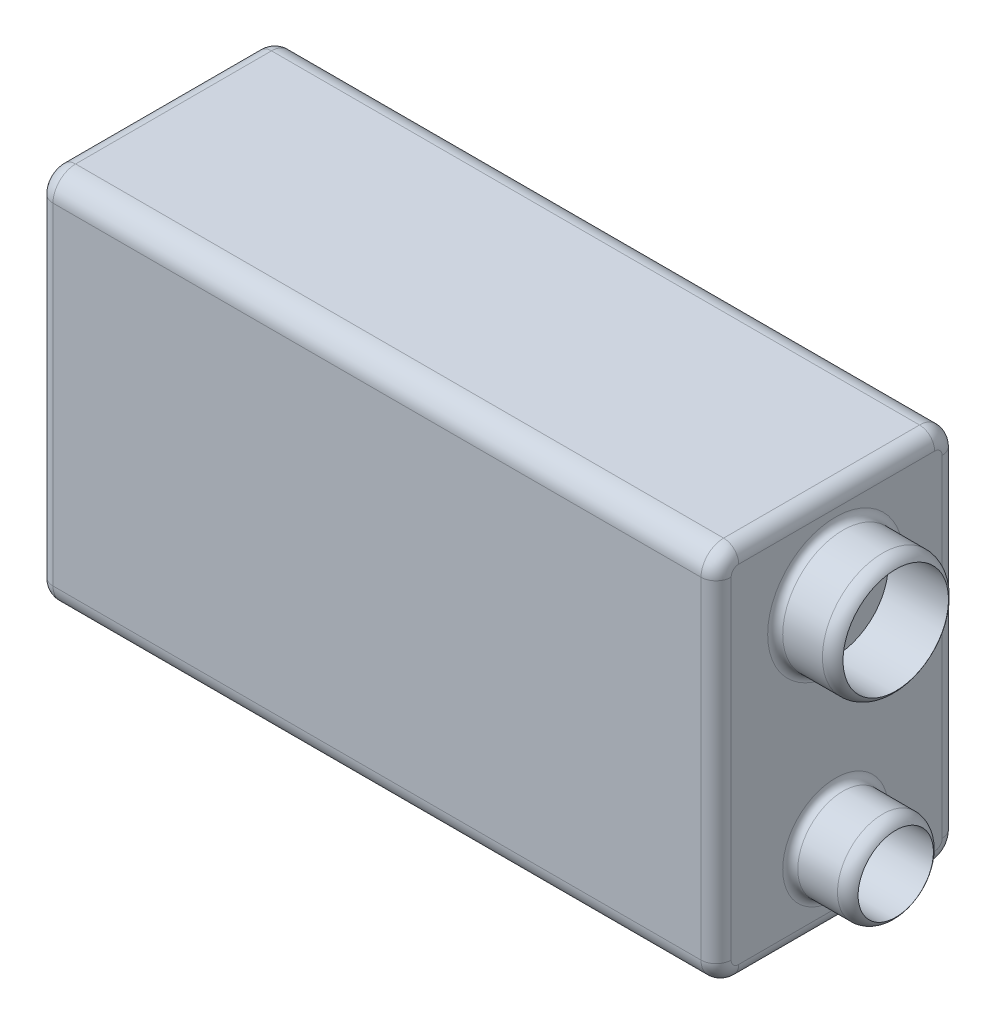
SolidWorks part; units mm, degrees
ref_plane "Plan de face" through (0, 0, 0) normal (0, 0, 1) x (1, 0, 0)
ref_plane "Plan de dessus" through (0, 0, 0) normal (0, 1, 0) x (1, 0, 0)
ref_plane "Plan de droite" through (0, 0, 0) normal (1, 0, 0) x (0, 0, -1)
sketch "Esquisse1" plane through (0, 0, 0) normal (0, 0, 1) x (1, 0, 0)
  line L1 (0, 0) -> (45, 0)
  line L2 (0, 0) -> (0, 25)
  line L3 (0, 25) -> (45, 25)
  line L4 (45, 0) -> (45, 25)
  dimension "D1" = 25
  dimension "D2" = 45
extrude "Boss.-Extru.1" add sketch "Esquisse1" along normal blind 16
sketch "Esquisse2" plane through (45, 0, 0) normal (1, 0, 0) x (0, 0, -1)
  line L0 (-16, 25) -> (0, 25) construction
  circle A0 centre (-8.078, 19) radius 4
  circle A1 centre (-8.078, 5) radius 3
  dimension "D2" = 8
  dimension "D3" = 6
  dimension "D1" = 14
  dimension "D4" = 6
extrude "Boss.-Extru.2" add sketch "Esquisse2" along normal blind 4
sketch "Esquisse3" plane through (45, 0, 0) normal (1, 0, 0) x (0, 0, -1)
  circle A0 centre (-8.078, 19) radius 3.5
  dimension "D1" = 7
extrude "Enlèv. mat.-Extru.2" cut sketch "Esquisse3" along normal blind 4
sketch "Esquisse4" plane through (49, 0, 0) normal (1, 0, 0) x (0, 0, -1)
  circle A0 centre (-8.078, 5) radius 2.5
  dimension "D1" = 5
extrude "Enlèv. mat.-Extru.3" cut sketch "Esquisse4" against normal blind 4
fillet "Congé1" radius 1.5 1 edges at (22.5, 25, 16)
fillet "Congé2" radius 1.5 1 edges at (22.5, 0, 16)
fillet "Congé3" radius 1.5 1 edges at (22.5, 25, 0)
fillet "Congé4" radius 1.5 1 edges at (22.5, 0, 0)
fillet "Congé5" radius 1 8 edges at (0, 24.5607, 0.4393) (0, 25, 8) (0, 24.5607, 15.5607) (0, 12.5, 16) (0, 0.4393, 15.5607) (0, 0, 8) (0, 0.4393, 0.4393) (0, 12.5, 0)
fillet "Congé6" radius 1 8 edges at (45, 0.4393, 15.5607) (45, 12.5, 16) (45, 24.5607, 15.5607) (45, 25, 8) (45, 24.5607, 0.4393) (45, 12.5, 0) (45, 0.4393, 0.4393) (45, 0, 8)
fillet "Congé8" radius 0.5 1 edges at (45, 19, 12.078)
fillet "Congé9" radius 0.5 1 edges at (45, 5, 11.078)
fillet "Congé10" radius 1 1 edges at (49, 19, 4.078)
fillet "Congé11" radius 1 1 edges at (49, 5, 5.078)
